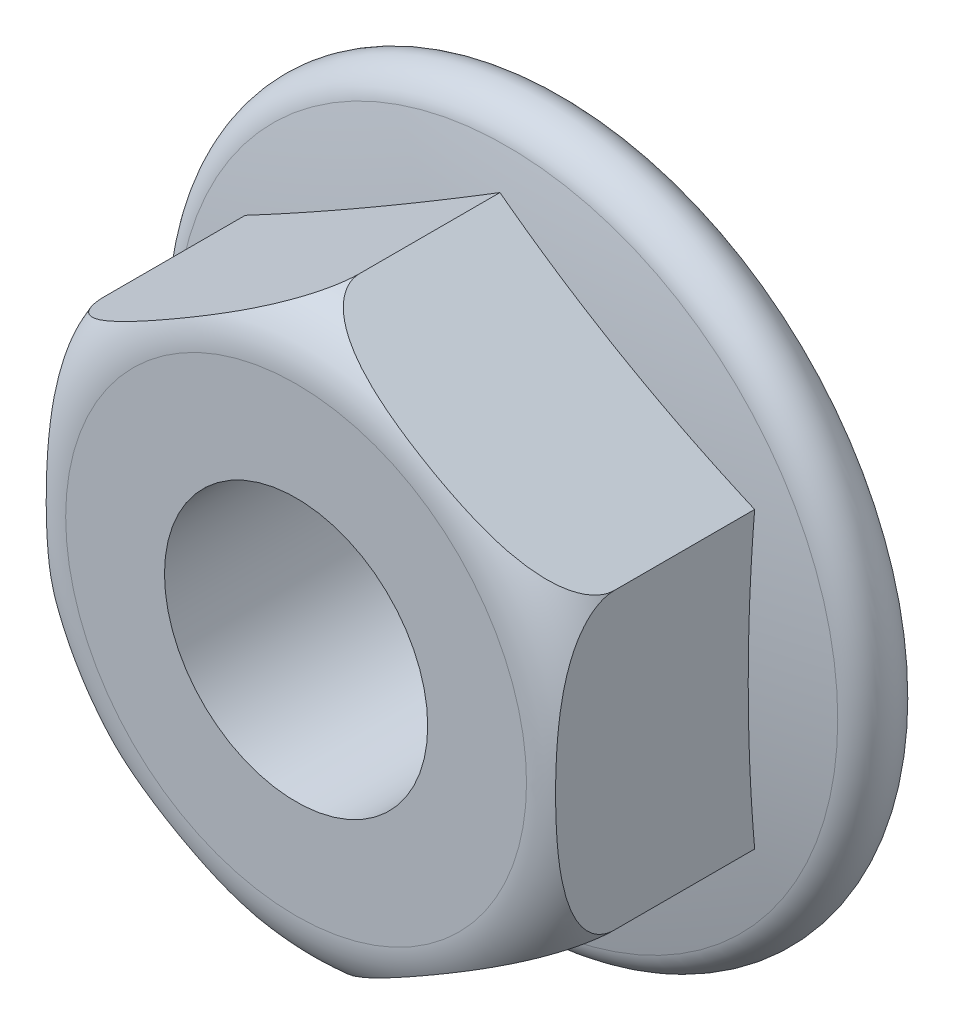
SolidWorks part; units mm, degrees
ref_plane "Plane1" through (0, 0, 0) normal (0, 0, 1) x (1, 0, 0)
ref_plane "Plane2" through (0, 0, 0) normal (0, 1, 0) x (-1, 0, 0)
ref_plane "Plane3" through (0, 0, 0) normal (1, 0, 0) x (0, 0, -1)
sketch "Head Sketch" plane through (0, 0, 0) normal (0, 0, 1) x (1, 0, 0)
  line L0 (0, 4.6188) -> (4, 2.3094)
  line L1 (4, 2.3094) -> (4, -2.3094)
  line L2 (4, -2.3094) -> (0, -4.6188)
  line L3 (0, -4.6188) -> (-4, -2.3094)
  line L4 (-4, -2.3094) -> (-4, 2.3094)
  line L5 (-4, 2.3094) -> (0, 4.6188)
  line L6 (4, 2.3094) -> (-4, -2.3094) construction
  line L7 (0, 4.6188) -> (0, -4.6188) construction
  line L8 (-4, 2.3094) -> (4, -2.3094) construction
  point P0 (0, 0)
  dimension "D1" = 60
  dimension "D2" = 60
  dimension "Flats" = 8
extrude "Head" add sketch "Head Sketch" along normal blind 4.3
sketch "Flange Sketch" plane through (0, 0, 0) normal (0, 1, 0) x (-1, 0, 0)
  line L0 (0, 1.8434) -> (0, 1.5) construction
  line L1 (-5.1, 0) -> (0, 0)
  line L2 (0, 50) -> (0, -50) construction
  line L4 (0, 0) -> (0, 1.5)
  line L5 (0, 0) -> (-4, 0) construction
  arc A0 (0, 1.5) -> (-5.1971, 0.9905) centre (0, -25.26) ccw
  arc A1 (-5.1, 0) -> (-5.1971, 0.9905) centre (-5.1, 0.5) cw
  dimension "D1" = 0.5
  dimension "D3" = 10.2
  dimension "Flange Height" = 1.5
revolve "Flange" add sketch "Flange Sketch" angle 360 about L0
sketch "Sketch5" plane through (0, 0, 0) normal (1, 0, 0) x (0, 0, -1)
  line L0 (-4.3, -3.6188) -> (-4.3, -4.6188)
  line L1 (-4.3, -4.6188) -> (-3.3, -4.6188)
  line L2 (-4.3, -4.6188) -> (-1.0984, -4.6188) construction
  line L3 (-4.3, -4.6188) -> (-4.3, -2.3094) construction
  line L5 (-15.0856, 0) -> (-8.1394, 0) construction
  line L6 (50, 0) -> (-50, 0) construction
  arc A0 (-4.3, -3.6188) -> (-3.3, -4.6188) centre (-3.3, -3.6188) ccw
  dimension "D1" = 1
revolve "Head Trim" cut sketch "Sketch5" angle 360 about L5
sketch "Hole Sketch" plane through (0, 0, 4.3) normal (0, 0, 1) x (1, 0, 0)
  line L0 (50, 0) -> (-50, 0) construction
  line L1 (0, -50) -> (0, 50) construction
  circle A0 centre (0, 0) radius 2.067
  dimension "Hole Dia" = 4.134
extrude "Through Hole" cut sketch "Hole Sketch" against normal through all
